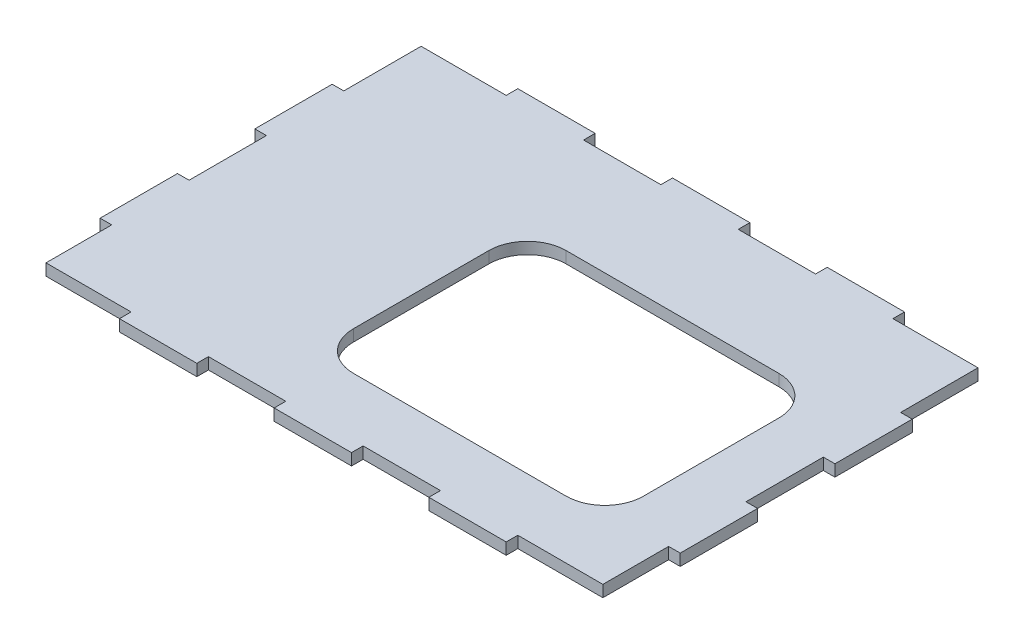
SolidWorks part; units mm, degrees
ref_plane "Alzado" through (0, 0, 0) normal (0, 0, 1) x (1, 0, 0)
ref_plane "Planta" through (0, 0, 0) normal (0, 1, 0) x (1, 0, 0)
ref_plane "Vista lateral" through (0, 0, 0) normal (1, 0, 0) x (0, 0, -1)
sketch "Sketch1" plane through (0, 0, 0) normal (0, 1, 0) x (1, 0, 0)
  line L1 (0, 0) -> (600, 0)
  line L2 (0, 0) -> (0, 800)
  line L3 (0, 800) -> (600, 800)
  line L4 (600, 0) -> (600, 800)
  dimension "D1" = 600
  dimension "D2" = 800
extrude "Boss-Extrude1" add sketch "Sketch1" along normal blind 12
sketch "Sketch2" plane through (0, 12, 0) normal (0, 1, 0) x (1, 0, 0)
  line L0 (588, 332) -> (588, 468)
  line L5 (0, 400) -> (600, 400) construction
  line L18 (0, 800) -> (0, 0) construction
  line L19 (600, 0) -> (600, 800) construction
  line L32 (0, 0) -> (600, 0) construction
  line L45 (0, 0) -> (100, 0)
  line L46 (0, 0) -> (0, 12)
  line L47 (12, 12) -> (100, 12)
  line L48 (100, 0) -> (100, 12)
  line L49 (180, 0) -> (260, 0)
  line L50 (180, 0) -> (180, 12)
  line L51 (180, 12) -> (260, 12)
  line L52 (260, 0) -> (260, 12)
  line L53 (600, 800) -> (600, 788)
  line L54 (340, 0) -> (420, 0)
  line L55 (340, 0) -> (340, 12)
  line L56 (340, 12) -> (420, 12)
  line L57 (420, 0) -> (420, 12)
  line L58 (500, 0) -> (600, 0)
  line L59 (500, 0) -> (500, 12)
  line L60 (500, 12) -> (588, 12)
  line L61 (600, 0) -> (600, 12)
  line L62 (500, 788) -> (588, 788)
  line L63 (500, 800) -> (500, 788)
  line L64 (500, 800) -> (600, 800)
  line L65 (420, 800) -> (420, 788)
  line L66 (340, 788) -> (420, 788)
  line L67 (340, 800) -> (340, 788)
  line L68 (340, 800) -> (420, 800)
  line L69 (260, 800) -> (260, 788)
  line L70 (180, 788) -> (260, 788)
  line L71 (180, 800) -> (180, 788)
  line L72 (180, 800) -> (260, 800)
  line L73 (100, 800) -> (100, 788)
  line L74 (12, 788) -> (100, 788)
  line L75 (0, 800) -> (0, 788)
  line L76 (0, 800) -> (100, 800)
  line L77 (300, 0) -> (300, 400) construction
  line L110 (600, 468) -> (588, 468)
  line L112 (0, 12) -> (0, 92)
  line L113 (0, 92) -> (12, 92)
  line L114 (12, 12) -> (12, 92)
  line L115 (0, 172) -> (12, 172)
  line L116 (0, 172) -> (0, 252)
  line L117 (0, 252) -> (12, 252)
  line L118 (12, 172) -> (12, 252)
  line L119 (0, 332) -> (12, 332)
  line L120 (0, 332) -> (0, 468)
  line L121 (0, 468) -> (12, 468)
  line L122 (12, 332) -> (12, 468)
  line L123 (600, 332) -> (600, 468)
  line L124 (600, 332) -> (588, 332)
  line L125 (588, 172) -> (588, 252)
  line L126 (600, 252) -> (588, 252)
  line L127 (600, 172) -> (600, 252)
  line L128 (600, 172) -> (588, 172)
  line L129 (600, 628) -> (588, 628)
  line L131 (600, 12) -> (600, 92)
  line L132 (600, 92) -> (588, 92)
  line L133 (588, 12) -> (588, 92)
  line L134 (600, 628) -> (600, 548)
  line L135 (600, 548) -> (588, 548)
  line L136 (588, 628) -> (588, 548)
  line L137 (12, 628) -> (12, 548)
  line L138 (0, 548) -> (12, 548)
  line L139 (0, 628) -> (0, 548)
  line L140 (0, 628) -> (12, 628)
  line L142 (0, 708) -> (12, 708)
  line L143 (0, 708) -> (0, 788)
  line L145 (12, 708) -> (12, 788)
  line L146 (600, 708) -> (588, 708)
  line L147 (600, 708) -> (600, 788)
  line L149 (588, 708) -> (588, 788)
extrude "Cut-Extrude1" cut sketch "Sketch2" against normal blind 12
sketch "Sketch3" plane through (0, 12, 0) normal (0, 1, 0) x (1, 0, 0)
  line L0 (100, 0) -> (180, 0) construction
  line L1 (0, 400) -> (650, 400)
  line L2 (0, 400) -> (0, 0)
  line L3 (0, 0) -> (650, 0)
  line L4 (650, 400) -> (650, 0)
  line L5 (0, 172) -> (0, 92) construction
  dimension "D1" = 400
  dimension "D2" = 650
extrude "Cut-Extrude2" cut sketch "Sketch3" against normal through all
sketch "Sketch4" plane through (0, 12, 0) normal (0, 1, 0) x (1, 0, 0)
  line L0 (588, 400) -> (12, 400) construction
  line L1 (270, 680) -> (490, 680)
  line L2 (230, 640) -> (230, 500)
  line L3 (270, 460) -> (490, 460)
  line L4 (530, 640) -> (530, 500)
  line L6 (600, 468) -> (600, 548) construction
  arc A0 (490, 680) -> (530, 640) centre (490, 640) cw
  arc A1 (490, 460) -> (530, 500) centre (490, 500) ccw
  arc A2 (230, 500) -> (270, 460) centre (270, 500) ccw
  arc A3 (270, 680) -> (230, 640) centre (270, 640) ccw
  point P12 (530, 460)
  point P15 (230, 460)
  point P18 (230, 680)
  dimension "D5" = 40
  dimension "D1" = 220
  dimension "D2" = 300
  dimension "D3" = 60
  dimension "D4" = 70
extrude "Cut-Extrude3" cut sketch "Sketch4" against normal through all
sketch "Sketch5" plane through (0, 12, 0) normal (0, 1, 0) x (1, 0, 0)
  line L29 (100, 400) -> (100, 388)
  line L34 (588, 400) -> (12, 400) construction
  line L35 (100, 388) -> (180, 388)
  line L36 (180, 388) -> (180, 400)
  line L37 (180, 400) -> (100, 400)
  line L38 (0, 548) -> (0, 468) construction
  line L40 (260, 400) -> (340, 400)
  line L41 (260, 400) -> (260, 388)
  line L42 (260, 388) -> (340, 388)
  line L43 (340, 400) -> (340, 388)
  line L44 (420, 400) -> (500, 400)
  line L45 (420, 400) -> (420, 388)
  line L46 (420, 388) -> (500, 388)
  line L47 (500, 400) -> (500, 388)
  dimension "D1" = 12
  dimension "D2" = 100
  dimension "D3" = 80
  dimension "D4" = 80
  dimension "D5" = 80
  dimension "D6" = 80
  dimension "D7" = 80
extrude "Boss-Extrude3" add sketch "Sketch5" against normal blind 12
equation "\"mat\"= 12mm"
equation "\"pes\"= 80mm"
equation "\"sep\"= 80mm"
equation "\"D1@Boss-Extrude1\"=\"mat\""
equation "\"D1@Cut-Extrude1\"=\"mat\""
equation "\"D4@Sketch2\"=\"pes\""
equation "\"D5@Sketch2\"=\"sep\""
equation "\"D6@Sketch2\"=\"pes\""
equation "\"D7@Sketch2\"=\"mat\""
equation "\"D8@Sketch2\"=\"mat\""
equation "\"D9@Sketch2\"=\"mat\""
equation "\"D11@Sketch2\"=\"sep\""
equation "\"D12@Sketch2\"=\"pes\""
equation "\"D13@Sketch2\"=\"mat\""
equation "\"D14@Sketch2\"=\"pes\""
equation "\"D15@Sketch2\"=\"mat\""
equation "\"D16@Sketch2\"=\"sep\""
equation "\"D17@Sketch2\"=\"mat\""
equation "\"D18@Sketch2\"=\"sep\""
equation "\"D19@Sketch2\"=136"
equation "\"D20@Sketch2\"=\"pes\""
equation "\"D21@Sketch2\"=\"mat\""
equation "\"D23@Sketch2\"=\"mat\""
equation "\"D24@Sketch2\"=\"sep\""
equation "\"D25@Sketch2\"=\"pes\""
equation "\"D26@Sketch2\"=\"sep\""
equation "\"D27@Sketch2\"=\"pes\""
equation "\"D22@Sketch2\"=\"mat\""
equation "\"D3@Sketch2\"=\"mat\""
equation "\"D28@Sketch2\"=100"
equation "\"D29@Sketch2\"=\"mat\""
equation "\"D30@Sketch2\"=\"sep\""
